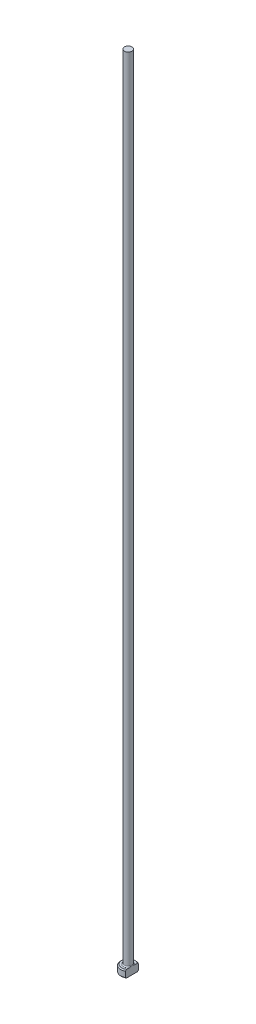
SolidWorks part; units mm, degrees
ref_plane "Front Plane" through (0, 0, 0) normal (0, 0, 1) x (1, 0, 0)
ref_plane "Top Plane" through (0, 0, 0) normal (0, 1, 0) x (1, 0, 0)
ref_plane "Right Plane" through (0, 0, 0) normal (1, 0, 0) x (0, 0, -1)
sketch "Sketch1" plane through (0, 0, 0) normal (0, 0, 1) x (1, 0, 0)
  line L0 (0, 259.9588) -> (0, -15.1925) construction
  line L1 (0, 0) -> (-1.5, 0)
  line L2 (-1.5, 0) -> (-1.5, 1.5)
  line L3 (-1.5, 1.5) -> (-0.75, 1.5)
  line L4 (-0.75, 1.5) -> (-0.75, 160)
  line L5 (-0.75, 160) -> (0, 160)
  line L6 (0, 160) -> (0, 0)
  dimension "L" = 160
  dimension "H" = 3
  dimension "T" = 1.5
  dimension "D" = 1.5
revolve "Revolve1" add sketch "Sketch1" angle 360 about L0
chamfer "Chamfer1" distance 0.2 angle 45 2 edges at (0, 1.5, 1.5) (0, 0, 1.5)
fillet "Fillet1" radius 0.2 1 edges at (0, 1.5, 0.75)
sketch "Sketch2" plane through (0, 0, 0) normal (0, 1, 0) x (1, 0, 0)
  line L0 (0.75, 1.299) -> (0.75, -1.299)
  circle A0 centre (0, 0) radius 1.5 construction
  arc A1 (0.75, -1.299) -> (0.75, 1.299) centre (0, 0) ccw
  circle A2 centre (0, 0) radius 0.75 construction
extrude "KEY" cut sketch "Sketch2" along normal through all
